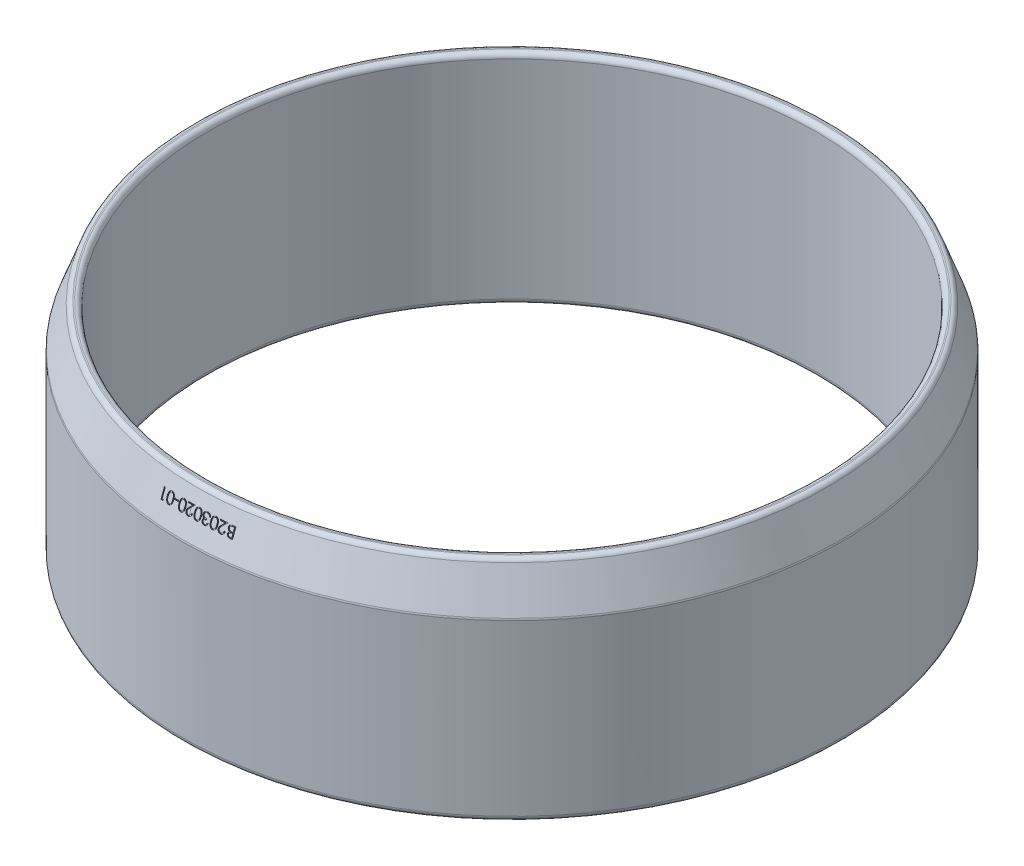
SolidWorks part; units mm, degrees
ref_plane "Спереди" through (0, 0, 0) normal (0, 0, 1) x (1, 0, 0)
ref_plane "Сверху" through (0, 0, 0) normal (0, 1, 0) x (1, 0, 0)
ref_plane "Справа" through (0, 0, 0) normal (1, 0, 0) x (0, 0, -1)
sketch "Эскиз1" plane through (0, 0, 0) normal (0, 0, 1) x (1, 0, 0)
  line L0 (0, 0) -> (0, 26.2757) construction
  line L1 (65, 0) -> (65, 34.6)
  line L2 (65, 34.6) -> (61.9427, 43)
  line L3 (61.9427, 43) -> (60, 43)
  line L4 (60, 43) -> (60, 0)
  line L5 (60, 0) -> (65, 0)
  dimension "D1" = 5
  dimension "D2" = 43
  dimension "D3" = 8.4
  dimension "D4" = 110
  dimension "D5" = 130
  dimension "D6" = 34.6
revolve "Повернуть1" add sketch "Эскиз1" angle 360 about L0
fillet "Скругление1" radius 1 5 edges at (0, 0, -65) (0, 34.6, -65) (0, 43, -60) (0, 0, -60) (0, 43, -61.9427)
ref_plane "Плоскость1" through (0, 24.938, 68.5167) normal (0, 0.342, 0.9397) x (1, 0, 0)
sketch "Эскиз2" plane through (0, 24.938, 68.5167) normal (0, 0.342, 0.9397) x (1, 0, 0)
  line L0 (-6.4233, 16.045) -> (8.5767, 16.045) construction
  text T0 "B203020-01" font "Century Gothic" height 2
  point P7 (1.0767, 16.045)
  dimension "D1" = 15
wrap "Перенос1" sketch "Эскиз2" wrap type deboss source sketch "Эскиз2" thickness 0.2 parameters "D1"=0.2
